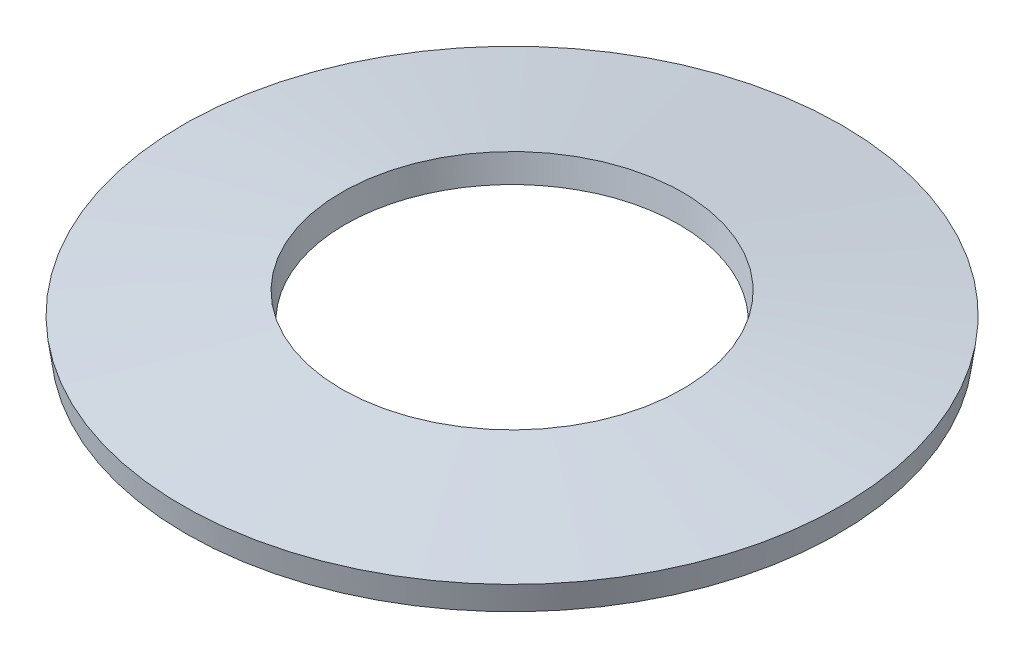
SolidWorks part; units mm, degrees
ref_plane "Front" through (0, 0, 0) normal (0, 0, 1) x (1, 0, 0)
ref_plane "Top" through (0, 0, 0) normal (0, 1, 0) x (1, 0, 0)
ref_plane "Right" through (0, 0, 0) normal (1, 0, 0) x (0, 0, -1)
sketch "Sketch1" plane through (0, 0, 0) normal (0, 0, 1) x (1, 0, 0)
  line L0 (4.7119, 0) -> (2.413, 0.3082)
  line L1 (2.413, 0.3082) -> (2.4636, 0.6858)
  line L2 (2.4636, 0.6858) -> (4.7625, 0.3776)
  line L3 (4.7625, 0.3776) -> (4.7119, 0)
  line L4 (0, 0) -> (0, 0.6858) construction
  dimension "ID" = 4.826
  dimension "OD" = 9.525
  dimension "Thickness" = 0.381
  dimension "Height" = 0.6858
revolve "Revolve1" add sketch "Sketch1" angle 360 about L4
